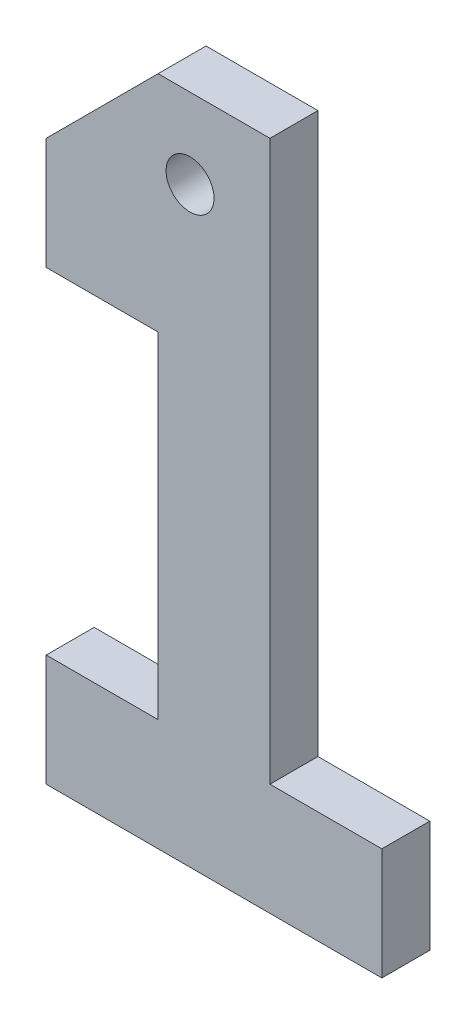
SolidWorks part; units mm, degrees
ref_plane "Front Plane" through (0, 0, 0) normal (0, 0, 1) x (1, 0, 0)
ref_plane "Top Plane" through (0, 0, 0) normal (0, 1, 0) x (1, 0, 0)
ref_plane "Right Plane" through (0, 0, 0) normal (1, 0, 0) x (0, 0, -1)
sketch "Sketch3" plane through (0, 0, 0) normal (0, 0, 1) x (1, 0, 0)
  line L0 (0, 0) -> (42, 0) construction
  line L1 (0, 0) -> (0, 84) construction
  line L2 (14, -28) -> (14, 84) construction
  line L3 (28, -2.8) -> (28, 84) construction
  line L4 (42, 0) -> (42, 84) construction
  line L5 (10, 0) -> (42, 0) construction
  line L6 (0, 14) -> (42, 14) construction
  line L7 (14, 14) -> (42, 14) construction
  line L8 (0, 28) -> (42, 28) construction
  line L9 (10, 28) -> (42, 28) construction
  line L10 (0, 42) -> (42, 42) construction
  line L11 (10, 42) -> (42, 42) construction
  line L12 (0, 56) -> (42, 56) construction
  line L13 (14, 56) -> (42, 56) construction
  line L14 (0, 70) -> (42, 70) construction
  line L15 (10, 70) -> (42, 70) construction
  line L16 (0, 84) -> (42, 84) construction
  line L17 (14, 84) -> (42, 84) construction
  line L18 (0, 0) -> (42, 0)
  line L19 (42, 0) -> (42, 14)
  line L20 (42, 14) -> (28, 14)
  line L21 (28, 14) -> (28, 84)
  line L22 (0, 0) -> (0, 14)
  line L23 (0, 14) -> (14, 14)
  line L24 (14, 14) -> (14, 56)
  line L25 (14, 56) -> (0, 56)
  line L26 (0, 56) -> (0, 70)
  line L27 (0, 70) -> (14, 84)
  line L28 (14, 84) -> (28, 84)
  circle A0 centre (18, 74) radius 3
  dimension "D1" = 6
  dimension "D2" = 10
  dimension "D3" = 10
  dimension "D4" = 14
  dimension "D5" = 14
  dimension "D6" = 14
  dimension "D7" = 84
extrude "Extrude1" add sketch "Sketch3" along normal blind 6
